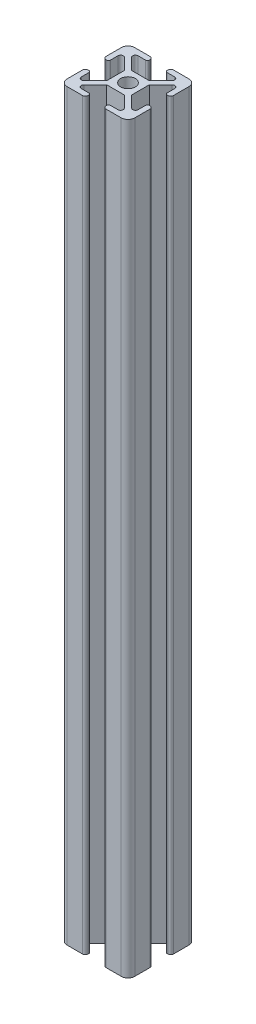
SolidWorks part; units mm, degrees
ref_plane "Alzado" through (0, 0, 0) normal (0, 0, 1) x (1, 0, 0)
ref_plane "Planta" through (0, 0, 0) normal (0, 1, 0) x (1, 0, 0)
ref_plane "Vista lateral" through (0, 0, 0) normal (1, 0, 0) x (0, 0, -1)
sketch "Croquis1" plane through (0, 0, 0) normal (0, 1, 0) x (1, 0, 0)
  line L0 (-10, 0) -> (0, 0) construction
  line L1 (-2.6143, 3.675) -> (2.6143, 3.675)
  line L2 (-3.675, 2.6143) -> (-3.675, -2.6143)
  line L3 (-2.6143, -3.675) -> (2.6143, -3.675)
  line L4 (3.675, 2.6143) -> (3.675, -2.6143)
  line L5 (-3.675, 3.675) -> (3.675, -3.675) construction
  line L6 (-3.675, -3.675) -> (3.675, 3.675) construction
  line L7 (0, 0) -> (0, 10) construction
  line L8 (-10, 8) -> (-10, 3.45)
  line L9 (10, 10) -> (-10, 10) construction
  line L10 (10, 10) -> (10, -10) construction
  line L11 (10, -10) -> (-10, -10) construction
  line L12 (-10, 10) -> (-10, -10) construction
  line L13 (10, 10) -> (-10, -10) construction
  line L14 (10, -10) -> (-10, 10) construction
  line L15 (-9.2, 2.65) -> (-8.9, 2.65)
  line L16 (-8.4, 3.15) -> (-8.4, 5.408)
  line L17 (-7.0343, 5.9737) -> (-3.675, 2.6143)
  line L18 (-5.9737, 7.0343) -> (-2.6143, 3.675)
  line L19 (-3.15, 8.4) -> (-5.408, 8.4)
  line L20 (-2.65, 9.2) -> (-2.65, 8.9)
  line L21 (-8, 10) -> (-3.45, 10)
  line L22 (8, 10) -> (3.45, 10)
  line L23 (2.65, 9.2) -> (2.65, 8.9)
  line L24 (3.15, 8.4) -> (5.408, 8.4)
  line L25 (5.9737, 7.0343) -> (2.6143, 3.675)
  line L26 (7.0343, 5.9737) -> (3.675, 2.6143)
  line L27 (8.4, 3.15) -> (8.4, 5.408)
  line L28 (9.2, 2.65) -> (8.9, 2.65)
  line L29 (10, 8) -> (10, 3.45)
  line L30 (-8, -10) -> (-3.45, -10)
  line L31 (-2.65, -9.2) -> (-2.65, -8.9)
  line L32 (-3.15, -8.4) -> (-5.408, -8.4)
  line L33 (-5.9737, -7.0343) -> (-2.6143, -3.675)
  line L34 (-7.0343, -5.9737) -> (-3.675, -2.6143)
  line L35 (-8.4, -3.15) -> (-8.4, -5.408)
  line L36 (-9.2, -2.65) -> (-8.9, -2.65)
  line L37 (-10, -8) -> (-10, -3.45)
  line L38 (10, -8) -> (10, -3.45)
  line L39 (9.2, -2.65) -> (8.9, -2.65)
  line L40 (8.4, -3.15) -> (8.4, -5.408)
  line L41 (7.0343, -5.9737) -> (3.675, -2.6143)
  line L42 (5.9737, -7.0343) -> (2.6143, -3.675)
  line L43 (3.15, -8.4) -> (5.408, -8.4)
  line L44 (2.65, -9.2) -> (2.65, -8.9)
  line L45 (8, -10) -> (3.45, -10)
  circle A0 centre (0, 0) radius 2.175
  arc A1 (-8.9, 2.65) -> (-8.4, 3.15) centre (-8.9, 3.15) ccw
  arc A2 (-10, 3.45) -> (-9.2, 2.65) centre (-9.2, 3.45) ccw
  arc A3 (-8.4, 5.408) -> (-7.0343, 5.9737) centre (-7.6, 5.408) cw
  arc A4 (-5.408, 8.4) -> (-5.9737, 7.0343) centre (-5.408, 7.6) ccw
  arc A5 (-3.45, 10) -> (-2.65, 9.2) centre (-3.45, 9.2) cw
  arc A6 (-2.65, 8.9) -> (-3.15, 8.4) centre (-3.15, 8.9) cw
  arc A7 (-10, 8) -> (-8, 10) centre (-8, 8) cw
  arc A8 (10, 8) -> (8, 10) centre (8, 8) ccw
  arc A9 (2.65, 8.9) -> (3.15, 8.4) centre (3.15, 8.9) ccw
  arc A10 (3.45, 10) -> (2.65, 9.2) centre (3.45, 9.2) ccw
  arc A11 (5.408, 8.4) -> (5.9737, 7.0343) centre (5.408, 7.6) cw
  arc A12 (8.4, 5.408) -> (7.0343, 5.9737) centre (7.6, 5.408) ccw
  arc A13 (10, 3.45) -> (9.2, 2.65) centre (9.2, 3.45) cw
  arc A14 (8.9, 2.65) -> (8.4, 3.15) centre (8.9, 3.15) cw
  arc A15 (-10, -8) -> (-8, -10) centre (-8, -8) ccw
  arc A16 (-2.65, -8.9) -> (-3.15, -8.4) centre (-3.15, -8.9) ccw
  arc A17 (-3.45, -10) -> (-2.65, -9.2) centre (-3.45, -9.2) ccw
  arc A18 (-5.408, -8.4) -> (-5.9737, -7.0343) centre (-5.408, -7.6) cw
  arc A19 (-8.4, -5.408) -> (-7.0343, -5.9737) centre (-7.6, -5.408) ccw
  arc A20 (-10, -3.45) -> (-9.2, -2.65) centre (-9.2, -3.45) cw
  arc A21 (-8.9, -2.65) -> (-8.4, -3.15) centre (-8.9, -3.15) cw
  arc A22 (8.9, -2.65) -> (8.4, -3.15) centre (8.9, -3.15) ccw
  arc A23 (10, -3.45) -> (9.2, -2.65) centre (9.2, -3.45) ccw
  arc A24 (8.4, -5.408) -> (7.0343, -5.9737) centre (7.6, -5.408) cw
  arc A25 (5.408, -8.4) -> (5.9737, -7.0343) centre (5.408, -7.6) ccw
  arc A26 (3.45, -10) -> (2.65, -9.2) centre (3.45, -9.2) cw
  arc A27 (2.65, -8.9) -> (3.15, -8.4) centre (3.15, -8.9) cw
  arc A28 (10, -8) -> (8, -10) centre (8, -8) cw
  point P0 (0, 0)
  point P22 (-10, 2.65)
  point P24 (-9.05, 2.65)
  point P36 (-2.65, 10)
  point P63 (2.65, 10)
  point P64 (10, 2.65)
  point P88 (-2.65, -10)
  point P89 (-10, -2.65)
  point P113 (10, -2.65)
  point P114 (2.65, -10)
  dimension "D3" = 4.35
  dimension "D6" = 0.5
  dimension "D8" = 0.8
  dimension "D10" = 0.8
  dimension "D12" = 2
  dimension "D1" = 7.35
  dimension "D4" = 20
  dimension "D5" = 20
  dimension "D7" = 1.6
  dimension "D9" = 7.35
  dimension "D11" = 0.75
extrude "Saliente-Extruir1" add sketch "Croquis1" along normal blind 220
